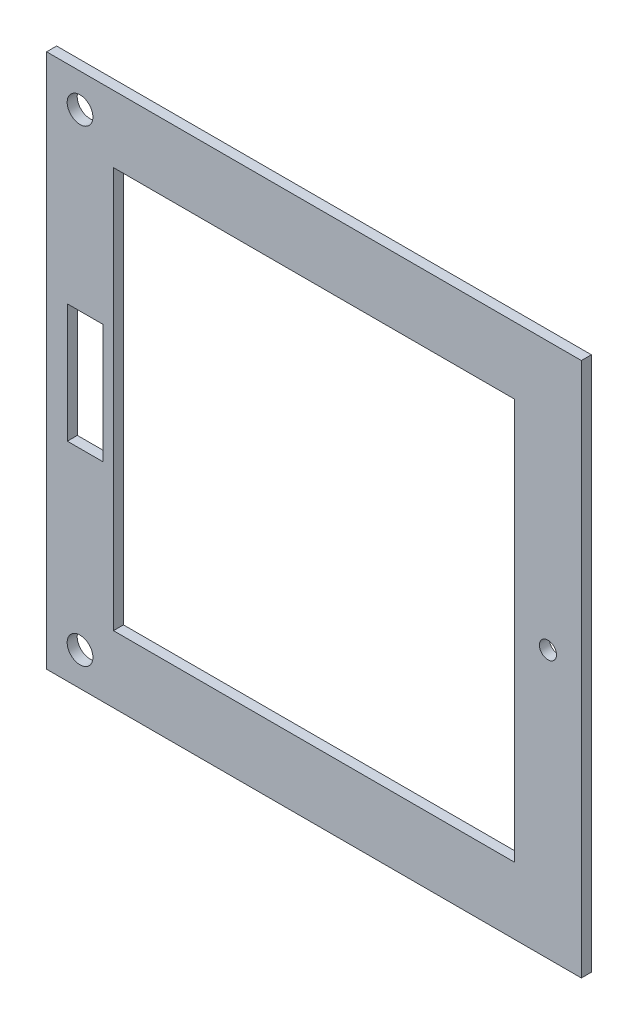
SolidWorks part; units mm, degrees
ref_plane "Plan de face" through (0, 0, 0) normal (0, 0, 1) x (1, 0, 0)
ref_plane "Plan de dessus" through (0, 0, 0) normal (0, 1, 0) x (1, 0, 0)
ref_plane "Plan de droite" through (0, 0, 0) normal (1, 0, 0) x (0, 0, -1)
sketch "Esquisse1" plane through (0, 0, 0) normal (0, 0, 1) x (1, 0, 0)
  line L1 (0, 0) -> (240, 0)
  line L2 (0, 0) -> (0, 240)
  line L3 (0, 240) -> (240, 240)
  line L4 (240, 0) -> (240, 240)
  line L5 (-40, -40) -> (280, -40)
  line L6 (-40, -40) -> (-40, 280)
  line L7 (-40, 280) -> (280, 280)
  line L8 (280, -40) -> (280, 280)
  dimension "D1" = 320
  dimension "D2" = 320
  dimension "D3" = 240
  dimension "D4" = 240
  dimension "D5" = 40
  dimension "D6" = 40
extrude "Boss.-Extru.2" add sketch "Esquisse1" along normal blind 6
sketch "Esquisse2" plane through (0, 0, 6) normal (0, 0, 1) x (1, 0, 0)
  line L0 (-40, 280) -> (-40, -40) construction
  line L1 (-27.6, 155.6) -> (-6.4, 155.6)
  line L2 (-27.6, 155.6) -> (-27.6, 84.4)
  line L3 (-27.6, 84.4) -> (-6.4, 84.4)
  line L4 (-6.4, 155.6) -> (-6.4, 84.4)
  line L6 (280, 280) -> (-40, 280) construction
  line L7 (-40, -40) -> (280, -40) construction
  line L8 (280, -40) -> (280, 280) construction
  line L9 (280, -40) -> (280, 280) construction
  circle A0 centre (-20, 260) radius 7.7
  circle A1 centre (260, 120) radius 5.1
  circle A2 centre (-20, -20) radius 7.7
  point P14 (-13.1578, 280)
  point P17 (280, 120)
  dimension "D1" = 15.4
  dimension "D2" = 15.4
  dimension "D3" = 10.2
  dimension "D4" = 20
  dimension "D5" = 20
  dimension "D6" = 20
  dimension "D7" = 20
  dimension "D8" = 20
  dimension "D9" = 160
  dimension "D10" = 71.2
  dimension "D11" = 21.2
  dimension "D12" = 124.4
  dimension "D13" = 12.4
extrude "Enlèv. mat.-Extru.1" cut sketch "Esquisse2" against normal blind 6
